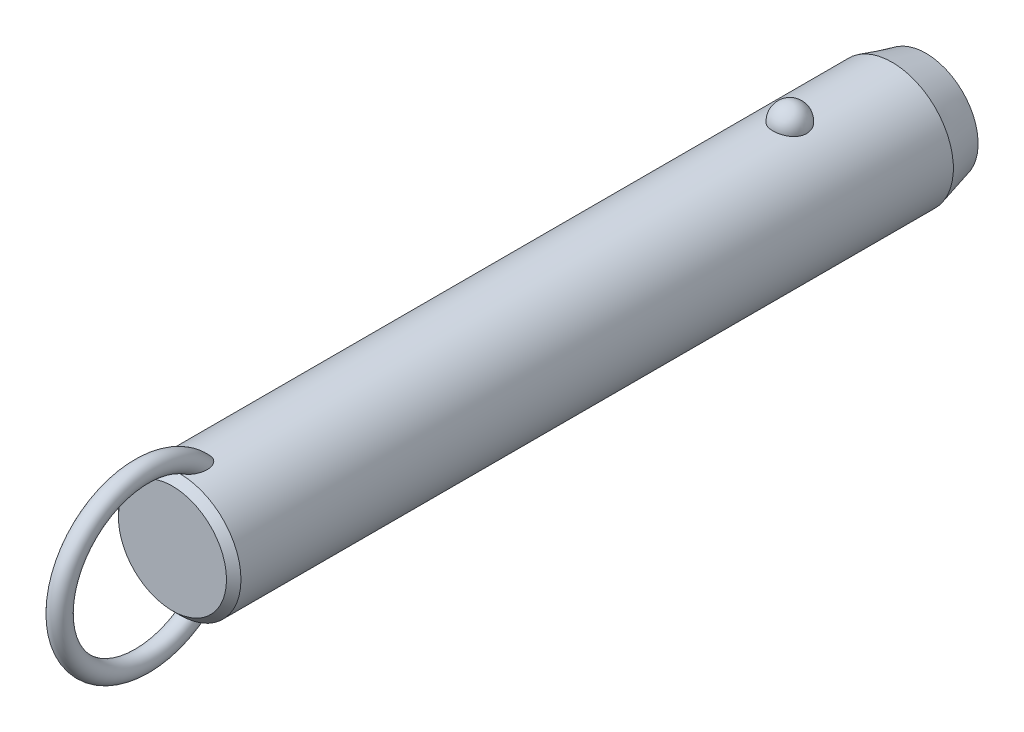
SolidWorks part; units mm, degrees
ref_plane "Front Plane" through (0, 0, 0) normal (0, 0, 1) x (1, 0, 0)
ref_plane "Top Plane" through (0, 0, 0) normal (0, 1, 0) x (1, 0, 0)
ref_plane "Right Plane" through (0, 0, 0) normal (1, 0, 0) x (0, 0, -1)
sketch "Sketch2" plane through (0, 0, 0) normal (0, 0, 1) x (1, 0, 0)
  circle A0 centre (0, 0) radius 12.7
  point P3 (0, 12.7)
  dimension "D1" = 25.4
extrude "Boss-Extrude1" add sketch "Sketch2" along normal blind 111.8
sketch "Sketch3" plane through (0, 0, 0) normal (0, 0, -1) x (-1, 0, 0)
  circle A0 centre (0, 0) radius 12.7
  dimension "D1" = 25.4
extrude "Boss-Extrude2" add sketch "Sketch3" along normal blind 31.7
chamfer "Chamfer1" distance 7 angle 15 1 edges at (-12.7, 0, -31.7)
sketch "Sketch12" plane through (0, 0, 0) normal (1, 0, 0) x (0, 0, -1)
  line L0 (-111.8, 12.7) -> (-111.8, -12.7) construction
  point P0 (-111.8, 0)
sketch "Sketch13" plane through (0, 0, 0) normal (1, 0, 0) x (0, 0, -1)
  circle A0 centre (-130.85, 0) radius 19.05
  point P2 (-111.8, 0)
  dimension "D1" = 38.1
sketch "Sketch14" plane through (0, 0, 0) normal (0, 1, 0) x (1, 0, 0)
  circle A0 centre (0, -113.8) radius 2
  point P2 (0, -111.8)
  dimension "D1" = 4
sweep "Sweep1" add profiles "Sketch14" path "Sketch13"
sketch "Sketch15" plane through (0, 0, 111.8) normal (0, 0, 1) x (1, 0, 0)
  circle A0 centre (0, 0) radius 12.7
  dimension "D1" = 25.4
extrude "Boss-Extrude3" add sketch "Sketch15" along normal blind 12.7
chamfer "Chamfer2" distance 1.5 angle 45 1 edges at (12.7, 0, 124.5)
sketch "Sketch18" plane through (0, 0, 0) normal (1, 0, 0) x (0, 0, -1)
  line L0 (24.7, 12.7) -> (-116.651, 12.7) construction
  line L1 (3.5, 16.2) -> (3.5, 9.2)
  line L2 (-116.651, -12.7) -> (24.7, -12.7) construction
  arc A0 (3.5, 16.2) -> (3.5, 9.2) centre (3.5, 12.7) ccw
  point P4 (0, 12.7)
  dimension "D1" = 28.9
revolve "Revolve1" add sketch "Sketch18" angle 360 about L1
